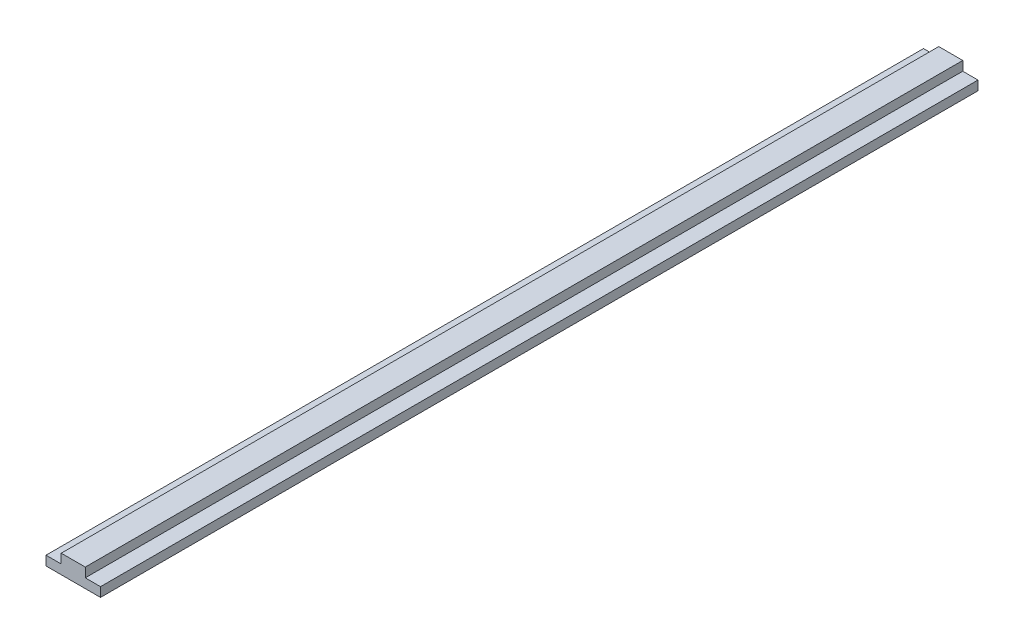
SolidWorks part; units mm, degrees
ref_plane "Plan de face" through (0, 0, 0) normal (0, 0, 1) x (1, 0, 0)
ref_plane "Plan de dessus" through (0, 0, 0) normal (0, 1, 0) x (1, 0, 0)
ref_plane "Plan de droite" through (0, 0, 0) normal (1, 0, 0) x (0, 0, -1)
sketch "Sketch5" plane through (0, 0, 0) normal (0, 1, 0) x (1, 0, 0)
  line L0 (-282.66, -1174) -> (273.84, -1174) construction
  line L1 (0, 0) -> (36.46, 0)
  line L2 (-36.46, 0) -> (0, 0)
  line L3 (-36.46, -1174) -> (36.46, -1174)
  line L4 (36.46, 0) -> (36.46, -1174)
  line L5 (-36.46, 0) -> (-36.46, -1174)
  line L6 (-36.46, -1099.8333) -> (-36.46, -1124.8333) construction
extrude "Boss-Extrude2" add sketch "Sketch5" along normal blind 25 separate body
sketch "Sketch6" plane through (0, 25, 0) normal (0, 1, 0) x (1, 0, 0)
  line L0 (-36.46, -1174) -> (36.46, -1174) construction
  line L1 (-36.46, 0) -> (-16.0753, 0)
  line L2 (-36.46, 0) -> (-36.46, -1174)
  line L3 (-36.46, -1174) -> (-16.0753, -1174)
  line L4 (-16.0753, 0) -> (-16.0753, -1174)
  line L5 (0, 0) -> (0, -1174) construction
  line L6 (36.46, 0) -> (-36.46, 0) construction
  line L7 (36.46, 0) -> (16.0753, 0)
  line L8 (36.46, 0) -> (36.46, -1174)
  line L9 (36.46, -1174) -> (16.0753, -1174)
  line L10 (16.0753, 0) -> (16.0753, -1174)
  line L11 (-36.46, -588) -> (0, -588) construction
  line L12 (0, -588) -> (36.46, -588) construction
  line L13 (-16.1753, -1099.8333) -> (-16.1753, -1124.8333) construction
extrude "Cut-Extrude1" cut sketch "Sketch6" against normal blind 12.5
ref_plane "Plane1" through (0, 0, 0) normal (1, 0, 0) x (0, 0, -1)
equation "\"tool_diameter\"=10"
equation "\"hole_clearance\"=0.1"
equation "\"material_thickness\"=25"
equation "\"clearance\"=0.1"
equation "\"outer_slot\"=0.5"
equation "\"fillet\"=7"
equation "\"string\"= 2 * \"tool_diameter\" / 2 * cos ( 45deg )"
equation "\"angle\"= IIF ( \"string\" < \"limit\" , 45 , ( 180 - 2 * arcsin ( \"ThicknessVStool_dia\" ) ) / 2 )"
equation "\"limit\"= \"material_thickness\" / 2 * 5 / 6"
equation "\"ThicknessVStool_dia\"= IIF ( \"limit\" / \"tool_diameter\" > 1 , 1 , \"limit\" / \"tool_diameter\" )"
equation "\"D1\"= \"angle\""
equation "\"D1@Boss-Extrude2\"=\"material_thickness\""
equation "\"D1@Cut-Extrude1\"=\"material_thickness\"/2"
equation "\"D1@Sketch6\"=\"clearance\""
